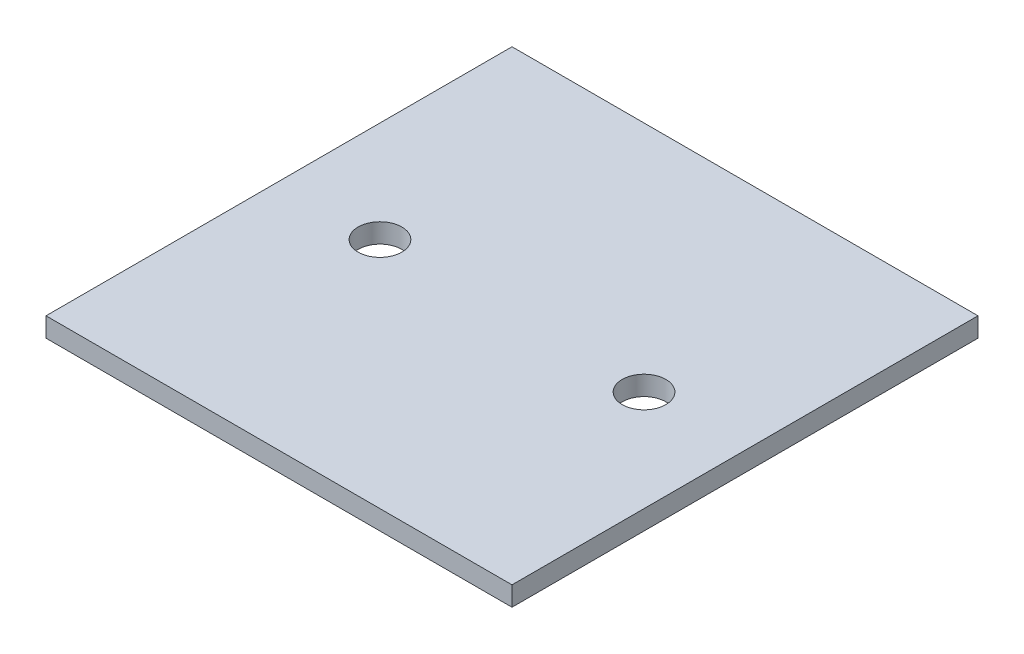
SolidWorks part; units mm, degrees
ref_plane "Front Plane" through (0, 0, 0) normal (0, 0, 1) x (1, 0, 0)
ref_plane "Top Plane" through (0, 0, 0) normal (0, 1, 0) x (1, 0, 0)
ref_plane "Right Plane" through (0, 0, 0) normal (1, 0, 0) x (0, 0, -1)
sketch "Sketch1" plane through (0, 0, 0) normal (0, 1, 0) x (1, 0, 0)
  line L1 (-76.2, 76.2) -> (76.2, 76.2)
  line L2 (-76.2, 76.2) -> (-76.2, -76.2)
  line L3 (-76.2, -76.2) -> (76.2, -76.2)
  line L4 (76.2, 76.2) -> (76.2, -76.2)
  point P4 (0, 76.2)
  point P6 (-76.2, 0)
  dimension "D1" = 152.4
  dimension "D2" = 152.4
extrude "Boss-Extrude1" add sketch "Sketch1" along normal blind 6.35
sketch "Sketch2" plane through (0, 0, 0) normal (0, 1, 0) x (1, 0, 0)
  circle A0 centre (-43.18, 0) radius 7.1437
  circle A1 centre (43.18, 0) radius 7.1437
  dimension "D3" = 14.2875
  dimension "D4" = 14.2875
  dimension "D1" = 43.18
  dimension "D2" = 43.18
extrude "Cut-Extrude1" cut sketch "Sketch2" along normal blind 25.4
